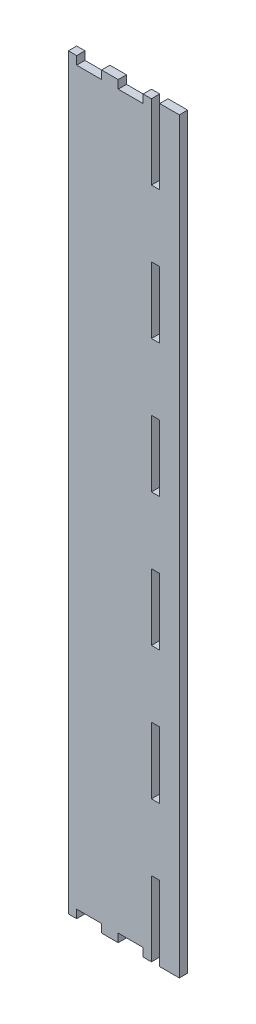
SolidWorks part; units mm, degrees
ref_plane "Front Plane" through (0, 0, 0) normal (0, 0, 1) x (1, 0, 0)
ref_plane "Top Plane" through (0, 0, 0) normal (0, 1, 0) x (1, 0, 0)
ref_plane "Right Plane" through (0, 0, 0) normal (1, 0, 0) x (0, 0, -1)
sketch "Model" plane through (0, 0, 0) normal (0, 0, 1) x (1, 0, 0)
  line L0 (186.6857, -118.6582) -> (186.6857, -158.6582)
  line L1 (156.6857, -243.6582) -> (156.6857, -238.6582)
  line L2 (186.6857, 121.3418) -> (186.6857, 81.3418)
  line L3 (186.6857, 41.3418) -> (186.6857, 1.3418)
  line L4 (186.6857, -38.6582) -> (186.6857, -78.6582)
  line L5 (156.6857, -238.6582) -> (141.6857, -238.6582)
  line L6 (141.6857, -238.6582) -> (141.6857, -243.6582)
  line L7 (141.6857, -243.6582) -> (136.6857, -243.6582)
  line L8 (136.6857, 206.3418) -> (136.6857, -243.6582)
  line L9 (141.6857, 206.3418) -> (136.6857, 206.3418)
  line L10 (141.6857, 201.3418) -> (141.6857, 206.3418)
  line L11 (156.6857, 201.3418) -> (141.6857, 201.3418)
  line L12 (156.6857, 206.3418) -> (156.6857, 201.3418)
  line L13 (166.6857, 206.3418) -> (156.6857, 206.3418)
  line L14 (166.6857, 201.3418) -> (166.6857, 206.3418)
  line L15 (166.6857, 201.3418) -> (181.6857, 201.3418)
  line L16 (181.6857, 206.3418) -> (181.6857, 201.3418)
  line L17 (186.6857, 206.3418) -> (181.6857, 206.3418)
  line L18 (186.6857, 161.3418) -> (186.6857, 206.3418)
  line L19 (186.6857, 161.3418) -> (191.6857, 161.3418)
  line L20 (191.6857, 161.3418) -> (191.6857, 206.3418)
  line L21 (203.4867, 206.3418) -> (191.6857, 206.3418)
  line L22 (203.4867, 206.3418) -> (203.4867, -243.6582)
  line L23 (203.4867, -243.6582) -> (191.6857, -243.6582)
  line L24 (191.6857, -243.6582) -> (191.6857, -198.6582)
  line L25 (191.6857, -198.6582) -> (186.6857, -198.6582)
  line L26 (186.6857, -198.6582) -> (186.6857, -243.6582)
  line L27 (186.6857, -243.6582) -> (181.6857, -243.6582)
  line L28 (181.6857, -243.6582) -> (181.6857, -238.6582)
  line L29 (181.6857, -238.6582) -> (166.6857, -238.6582)
  line L30 (166.6857, -238.6582) -> (166.6857, -243.6582)
  line L31 (166.6857, -243.6582) -> (156.6857, -243.6582)
  line L32 (186.6857, 81.3418) -> (191.6857, 81.3418)
  line L33 (191.6857, 81.3418) -> (191.6857, 121.3418)
  line L34 (191.6857, 121.3418) -> (186.6857, 121.3418)
  line L35 (186.6857, 1.3418) -> (191.6857, 1.3418)
  line L36 (191.6857, 1.3418) -> (191.6857, 41.3418)
  line L37 (191.6857, 41.3418) -> (186.6857, 41.3418)
  line L38 (186.6857, -78.6582) -> (191.6857, -78.6582)
  line L39 (191.6857, -78.6582) -> (191.6857, -38.6582)
  line L40 (191.6857, -38.6582) -> (186.6857, -38.6582)
  line L41 (186.6857, -158.6582) -> (191.6857, -158.6582)
  line L42 (191.6857, -158.6582) -> (191.6857, -118.6582)
  line L43 (191.6857, -118.6582) -> (186.6857, -118.6582)
extrude "Boss-Extrude1" add sketch "Model" along normal blind 5
